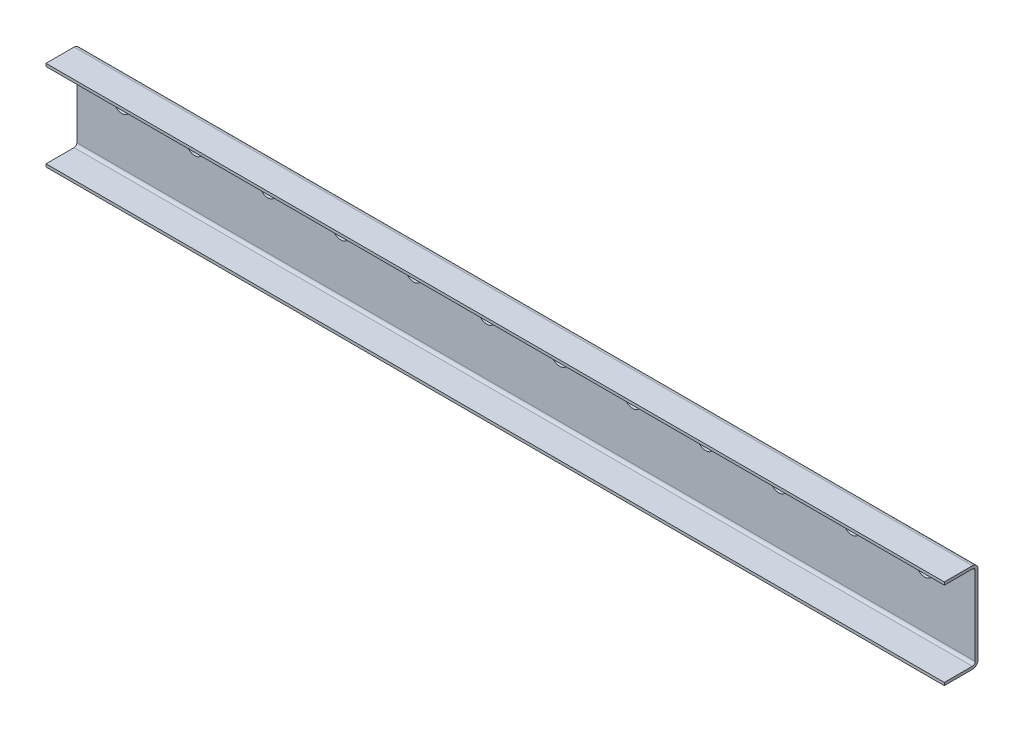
SolidWorks part; units mm, degrees
ref_plane "Plane1" through (0, 0, 0) normal (0, 0, 1) x (1, 0, 0)
ref_plane "Plane2" through (0, 0, 0) normal (0, 1, 0) x (1, 0, 0)
ref_plane "Plane3" through (0, 0, 0) normal (1, 0, 0) x (0, 0, -1)
sketch "Sketch1" plane through (0, 0, 0) normal (1, 0, 0) x (0, 0, -1)
  line L0 (0, 0) -> (0, -101.6)
  line L1 (0, -101.6) -> (-38.1, -101.6)
  line L2 (0, 0) -> (-38.1, 0)
  line L3 (-38.1, -101.6) -> (-38.1, 0) construction
  dimension "D1" = 38.1
  dimension "D2" = 101.6
extrude "Base-Extrude-Thin" add sketch "Sketch1" along normal blind 1016 thin
fillet "Fillet2" radius 3.175 2 edges at (508, -3.175, 3.175) (508, -98.425, 3.175)
fillet "Fillet1" radius 6.35 2 edges at (508, -101.6, 0) (508, 0, 0)
sketch "Sketch2" plane through (0, 0, 0) normal (0, 0, -1) x (-1, 0, 0)
  line L0 (0, -6.35) -> (0, -95.25) construction
  line L1 (-1016, 0) -> (0, 0) construction
  circle A0 centre (-50.8, -31.75) radius 9.525
  dimension "D1" = 19.05
  dimension "D2" = 50.8
  dimension "D3" = 31.75
extrude "Cut-Extrude1" cut sketch "Sketch2" against normal through all
pattern_linear "LPattern1" count 12 spacing 82.55 along (1, 0, 0) of "Cut-Extrude1"
